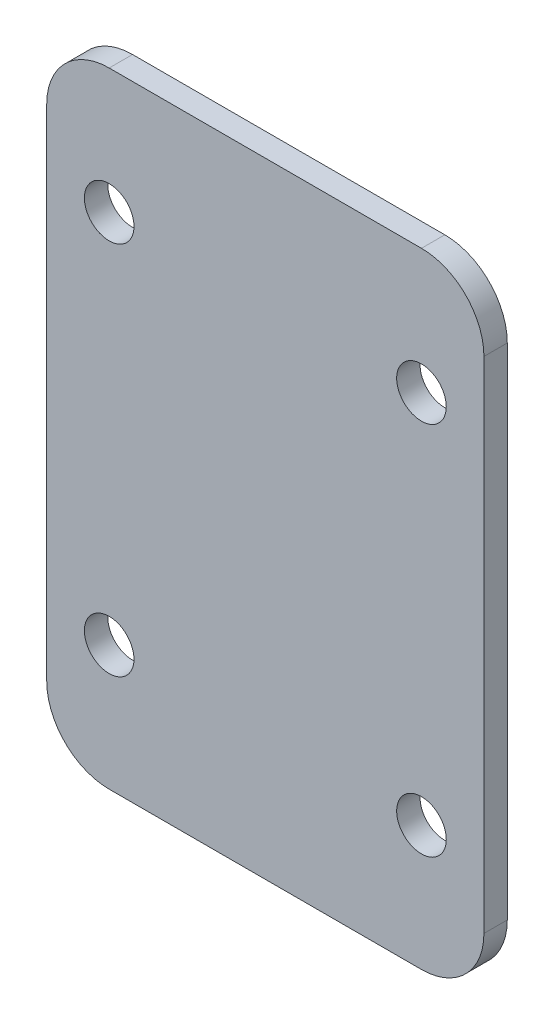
SolidWorks part; units mm, degrees
ref_plane "Plane1" through (0, 0, 0) normal (0, 0, 1) x (1, 0, 0)
ref_plane "Plane2" through (0, 0, 0) normal (0, 1, 0) x (1, 0, 0)
ref_plane "Plane3" through (0, 0, 0) normal (1, 0, 0) x (0, 0, -1)
sketch "Sketch1" plane through (0, 0, 0) normal (0, 0, 1) x (1, 0, 0)
  line L1 (0, 0) -> (88.9, 0)
  line L2 (0, 0) -> (0, 127)
  line L3 (0, 127) -> (88.9, 127)
  line L4 (88.9, 0) -> (88.9, 127)
  dimension "D1" = 127
  dimension "D2" = 88.9
extrude "Base-Extrude" add sketch "Sketch1" along normal blind 4.7498
sketch "Sketch2" plane through (0, 0, 4.7498) normal (0, 0, 1) x (1, 0, 0)
  line L0 (44.45, 135.0611) -> (44.45, -8.0611) construction
  line L1 (0, 127) -> (0, 0) construction
  line L4 (34.9377, 135.0611) -> (34.9377, -26.6189) construction
  line L5 (0, 127) -> (88.9, 127) construction
  line L6 (0, 0) -> (88.9, 0) construction
  circle A0 centre (12.7, 101.6) radius 5.0419
  circle A1 centre (12.7, 25.4) radius 5.0419
  circle A2 centre (76.2, 25.4) radius 5.0419
  circle A3 centre (76.2, 101.6) radius 5.0419
  dimension "D2" = 10.0838
  dimension "D8" = 10.0838
  dimension "D1" = 44.45
  dimension "D3" = 31.75
  dimension "D4" = 9.5123
  dimension "D5" = 25.4
  dimension "D6" = 25.4
  dimension "D7" = 31.75
extrude "MountHoles" cut sketch "Sketch2" against normal blind 4.7498
fillet "Fillet1" radius 12.7
equation "\"D1@Sketch2\" = \"D2@Sketch1\"/2"
